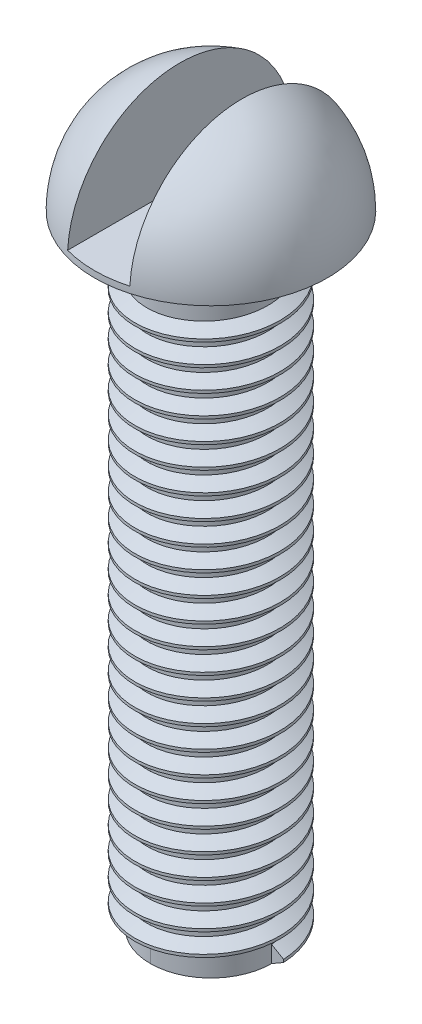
SolidWorks part; units mm, degrees
ref_plane "Front Plane" through (0, 0, 0) normal (0, 0, 1) x (1, 0, 0)
ref_plane "Top Plane" through (0, 0, 0) normal (0, 1, 0) x (1, 0, 0)
ref_plane "Right Plane" through (0, 0, 0) normal (1, 0, 0) x (0, 0, -1)
sketch "Sketch1" plane through (0, 0, 0) normal (0, 0, 1) x (1, 0, 0)
  line L1 (0, 5.6525) -> (0, -30.1015) construction
  line L2 (2.4765, 0) -> (4.7625, 0)
  line L5 (0, -25.4) -> (2.4765, -25.4)
  line L6 (2.4765, 0) -> (2.4765, -25.4)
  line L7 (0, 4.7625) -> (0, -25.4)
  arc A0 (4.7625, 0) -> (0, 4.7625) centre (0, 0) ccw
  dimension "D1" = 9.525
  dimension "D4" = 25.4
  dimension "D5" = 2.286
revolve "Revolve1" add sketch "Sketch1" angle 360 about L1
ref_plane "Plane1" through (0, 4.826, 0) normal (0, -1, 0) x (-1, 0, 0)
sketch "Sketch2" plane through (0, 4.826, 0) normal (0, -1, 0) x (-1, 0, 0)
  line L1 (1.27, -4.7625) -> (-1.27, -4.7625)
  line L2 (1.27, -4.7625) -> (1.27, 4.7625)
  line L3 (1.27, 4.7625) -> (-1.27, 4.7625)
  line L4 (-1.27, -4.7625) -> (-1.27, 4.7625)
  line L5 (1.27, -4.7625) -> (-1.27, 4.7625) construction
  line L6 (1.27, 4.7625) -> (-1.27, -4.7625) construction
  point P0 (0, 0)
  dimension "D1" = 9.525
  dimension "D2" = 2.54
extrude "Cut-Extrude1" cut sketch "Sketch2" along normal blind 4.572
thread "Thread1" pitch 0.9071 start angle 0, offset 0, length 22.86, pitch 0.9071, diameter 4.953
ref_plane "Plane2" through (2.4765, -25.4, 0) normal (0, 0, 1) x (1, 0, 0)
sketch "Thread Profile1" plane through (2.4765, -25.4, 0) normal (0, 0, 1) x (1, 0, 0)
  line L0 (0, 0) -> (0, 0.9071) construction
  line L1 (0, 0) -> (0.491, 0.2835)
  line L2 (0.491, 0.2835) -> (0.491, 0.3969)
  line L3 (0.491, 0.3969) -> (0, 0.6804)
  line L4 (0.491, 0.3402) -> (0, 0.3402) construction
  line L11 (0, 0) -> (0, 0.6804)
  point P2 (0, 0)
  dimension "Pitch" = 0.9071
  dimension "Profile_Angle" = 60
  dimension "Profile_Land" = 0.1134
  dimension "Profile_Height" = 0.491
